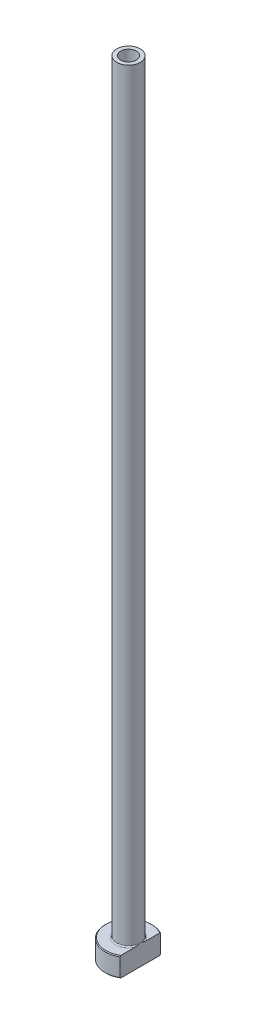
SolidWorks part; units mm, degrees
ref_plane "Front Plane" through (0, 0, 0) normal (0, 0, 1) x (1, 0, 0)
ref_plane "Top Plane" through (0, 0, 0) normal (0, 1, 0) x (1, 0, 0)
ref_plane "Right Plane" through (0, 0, 0) normal (1, 0, 0) x (0, 0, -1)
sketch "Sketch1" plane through (0, 0, 0) normal (0, 0, 1) x (1, 0, 0)
  line L0 (-2, 200) -> (-3, 200)
  line L1 (-3, 200) -> (-3, 5)
  line L2 (-3, 5) -> (-6, 5)
  line L3 (-6, 5) -> (-6, 0)
  line L4 (4.95, 0) -> (-4.95, 0) construction
  line L5 (-6, 0) -> (-2.25, 0)
  line L6 (-2, 155) -> (-2, 200)
  line L7 (0, 92.1877) -> (0, -15.5353) construction
  line L8 (0, -6.6) -> (0, 6.6) construction
  line L9 (-2, 155) -> (-2.25, 143)
  line L10 (-2.25, 143) -> (-2.25, 0)
  dimension "D1" = 0.25
  dimension "ID" = 4
  dimension "OD" = 6
  dimension "L" = 200
  dimension "H" = 12
  dimension "T" = 5
  dimension "N" = 45
  dimension "D2" = 12
  dimension "L-N" = 155
revolve "Revolve1" add sketch "Sketch1" angle 360 about L7
fillet "Fillet1" radius 0.3 1 edges at (0, 5, 3)
chamfer "Chamfer1" distance 0.2 angle 45 2 edges at (0, 5, 6) (0, 0, 6)
sketch "Sketch2" plane through (0, 0, 0) normal (0, -1, 0) x (1, 0, 0)
  line L0 (3, 5.1962) -> (3, -5.1962)
  circle A0 centre (0, 0) radius 6 construction
  arc A1 (3, 5.1962) -> (3, -5.1962) centre (0, 0) cw
  circle A2 centre (0, 0) radius 3 construction
extrude "Cut-Extrude1" cut sketch "Sketch2" against normal through all
chamfer "Chamfer2" distance 0.5 angle 45 1 edges at (0, 0, 2.25)
